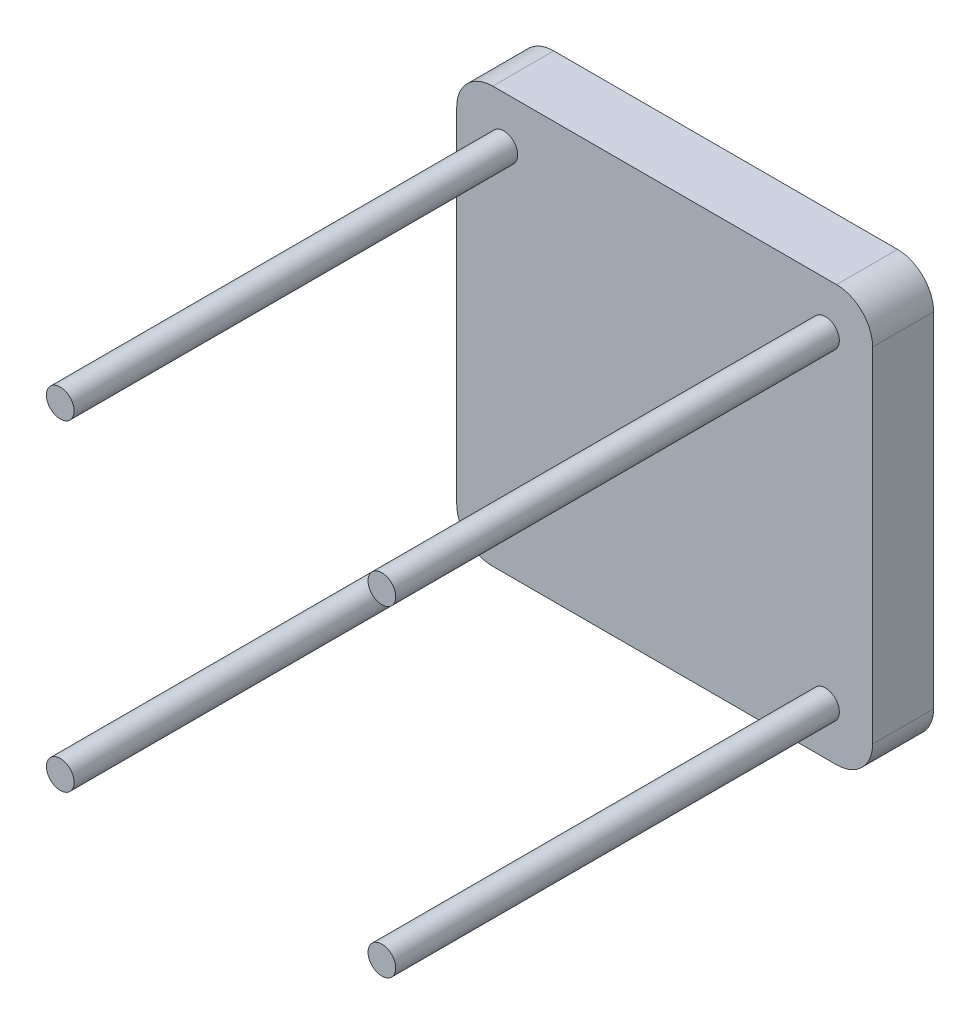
SolidWorks part; units mm, degrees
ref_plane "Plan de face" through (0, 0, 0) normal (0, 0, 1) x (1, 0, 0)
ref_plane "Plan de dessus" through (0, 0, 0) normal (0, 1, 0) x (1, 0, 0)
ref_plane "Plan de droite" through (0, 0, 0) normal (1, 0, 0) x (0, 0, -1)
sketch "Esquisse1" plane through (0, 0, 0) normal (0, 0, 1) x (1, 0, 0)
  line L1 (0, 0) -> (150, 0)
  line L2 (0, 0) -> (0, 150)
  line L3 (0, 150) -> (150, 150)
  line L4 (150, 0) -> (150, 150)
  dimension "D1" = 150
  dimension "D2" = 150
extrude "Extrusion1" add sketch "Esquisse1" along normal blind 22
fillet "Congé1" radius 13 4 edges at (0, 0, 11) (150, 0, 11) (0, 150, 11) (150, 150, 11)
sketch "Esquisse2" plane through (0, 0, 22) normal (0, 0, 1) x (1, 0, 0)
  line L0 (13, 0) -> (137, 0) construction
  line L1 (150, 13) -> (150, 137) construction
  circle A0 centre (133, 17) radius 5
  dimension "D3" = 10
  dimension "D1" = 17
  dimension "D2" = 17
extrude "Extrusion2" add sketch "Esquisse2" along normal blind 160
pattern_linear "Répétition linéaire1" count 2 spacing 116 along (-1, 0, 0) count 2 spacing 116 along (0, 1, 0) of "Extrusion2"
